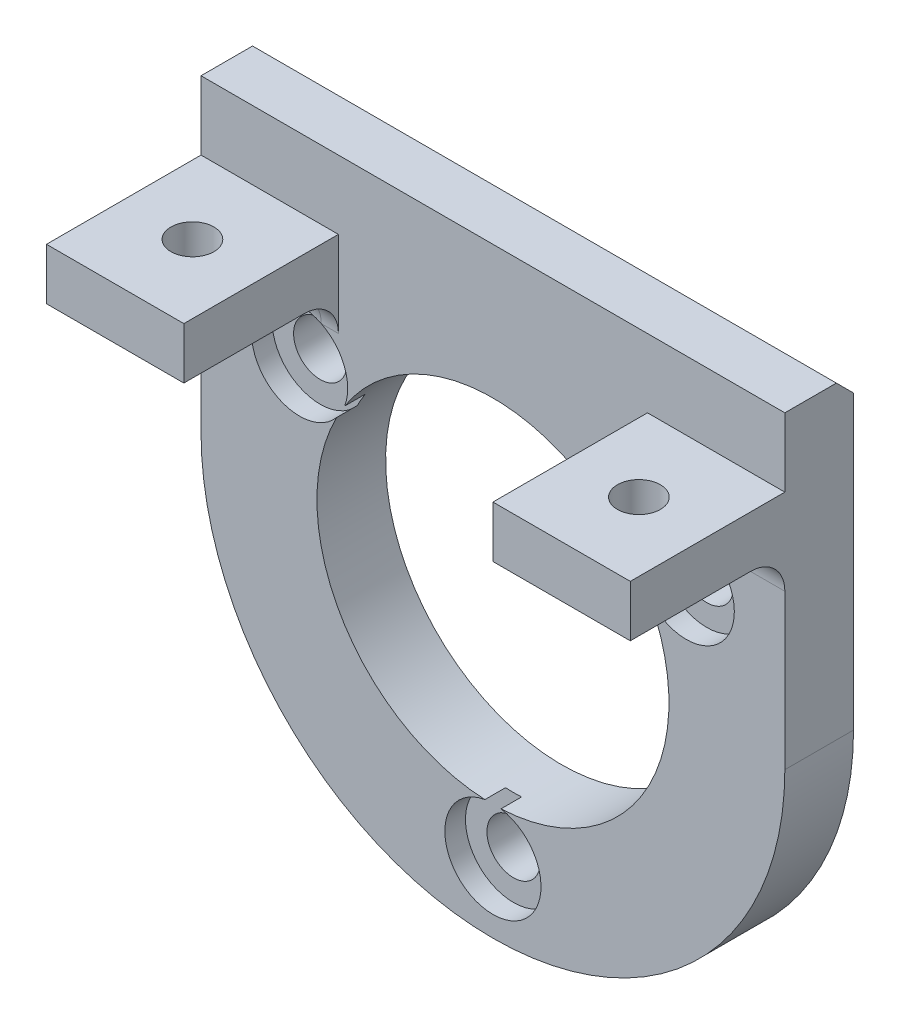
SolidWorks part; units mm, degrees
ref_plane "前视基准面" through (0, 0, 0) normal (0, 0, 1) x (1, 0, 0)
ref_plane "上视基准面" through (0, 0, 0) normal (0, 1, 0) x (1, 0, 0)
ref_plane "右视基准面" through (0, 0, 0) normal (1, 0, 0) x (0, 0, -1)
sketch "草图1" plane through (0, 0, 0) normal (0, 0, 1) x (1, 0, 0)
  circle A0 centre (0, 0) radius 10.25
  circle A1 centre (0, 0) radius 17
  dimension "D1" = 20.5
  dimension "D2" = 34
extrude "凸台-拉伸1" add sketch "草图1" along normal mid plane 4
sketch "草图2" plane through (0, 0, 0) normal (0, 0, 1) x (1, 0, 0)
  line L1 (-11.2583, 6.5) -> (0, -13) construction
  line L2 (0, -13) -> (11.2583, 6.5) construction
  line L3 (11.2583, 6.5) -> (-11.2583, 6.5) construction
  circle A0 centre (0, 0) radius 6.5 construction
  circle A1 centre (0, 0) radius 13 construction
  circle A2 centre (11.2583, 6.5) radius 1.55
  circle A3 centre (-11.2583, 6.5) radius 1.55
  circle A4 centre (0, -13) radius 1.55
  dimension "D1" = 26
  dimension "D2" = 3.1
extrude "切除-拉伸1" cut sketch "草图2" against normal through all both and the other way through all
sketch "草图3" plane through (0, 0, 2) normal (0, 0, 1) x (1, 0, 0)
  circle A0 centre (-11.2583, 6.5) radius 2.8
  circle A1 centre (11.2583, 6.5) radius 2.8
  circle A2 centre (0, -13) radius 2.8
  dimension "D1" = 5.6
extrude "切除-拉伸5" cut sketch "草图3" against normal blind 1.2
sketch "草图4" plane through (0, 0, 0) normal (0, 0, 1) x (1, 0, 0)
  line L0 (-17, 0) -> (-17, 14)
  line L1 (-17, 14) -> (17, 14)
  line L2 (17, 14) -> (17, 0)
  circle A0 centre (0, 0) radius 17 construction
  arc A1 (17, 0) -> (-17, 0) centre (0, 0) ccw
  dimension "D1" = 14
extrude "凸台-拉伸2" add sketch "草图4" along normal mid plane 4 contours A1 L1 L0 | A1 L2 L1
sketch "草图5" plane through (0, 0, 2) normal (0, 0, 1) x (1, 0, 0)
  line L1 (-17, 14) -> (-9, 14)
  line L2 (-17, 14) -> (-17, 11)
  line L3 (-17, 11) -> (-9, 11)
  line L4 (0, 0) -> (0, 7.2654) construction
  line L6 (-9, 11) -> (-9, 14)
  line L7 (9, 11) -> (9, 14)
  line L8 (17, 11) -> (9, 11)
  line L9 (17, 14) -> (17, 11)
  line L10 (-17, 0) -> (-17, 14) construction
  line L11 (9, 14) -> (17, 14)
  dimension "D1" = 3
  dimension "D2" = 14
  dimension "D3" = 8
extrude "凸台-拉伸3" add sketch "草图5" along normal blind 9
sketch "草图6" plane through (0, 0, 2) normal (0, 0, 1) x (1, 0, 0)
  line L0 (-17, 14) -> (-9, 14) construction
  line L1 (-17, 14) -> (17, 14)
  line L2 (-17, 14) -> (-17, 18)
  line L3 (-17, 18) -> (17, 18)
  line L4 (17, 14) -> (17, 18)
  point P6 (0, 18)
  dimension "D1" = 34
  dimension "D2" = 4
extrude "凸台-拉伸4" add sketch "草图6" against normal up to surface (4 mm away)
sketch "草图7" plane through (0, 14, 0) normal (0, 1, 0) x (1, 0, 0)
  line L0 (0, 0) -> (0, -11.015) construction
  line L1 (-9, -6.5) -> (-3.8874, -6.5) construction
  line L2 (-9, -11) -> (-9, -2) construction
  circle A0 centre (-13, -6.5) radius 1.45 construction
  circle A1 centre (13, -6.5) radius 1.45 construction
  point P12 (13, -6.5)
  point P17 (-13, -6.5)
  dimension "D1" = 2.9
  dimension "D2" = 26
hole_wizard "M3 螺纹孔2" positions "草图9" profile "草图10" tap size "M3" standard "GB"
sketch "草图9" plane through (0, 14, 0) normal (0, 1, 0) x (1, 0, 0)
  point P0 (-13, -6.5)
  point P3 (13, -6.5)
sketch "草图10" plane through (-13, 14, 6.5) normal (1, 0, 0) x (0, 0, 1)
  line L0 (0, 0) -> (0, 31)
  line L1 (0, 31) -> (1.25, 31)
  line L2 (1.25, 31) -> (1.25, 0)
  line L5 (1.25, 0) -> (0, 0)
  line L11 (0, -6.35) -> (0, 107.95) construction
  dimension "通孔螺纹孔钻头直径" = 2.5
  dimension "通孔螺纹孔钻头深度" = 31
fillet "圆角1" radius 2 2 edges at (13, 11, 2) (-13, 11, 2)
chamfer "倒角1" distance 1 angle 45 1 edges at (0, 18, -2)
